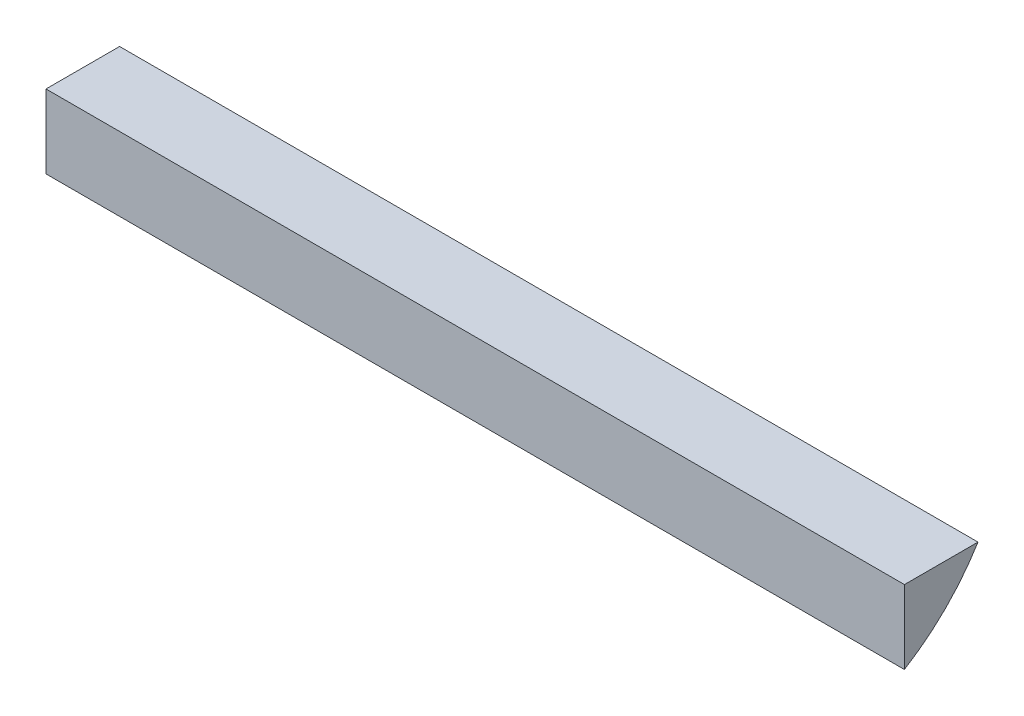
SolidWorks part; units mm, degrees
ref_plane "Face" through (0, 0, 0) normal (0, 0, 1) x (1, 0, 0)
ref_plane "Dessus" through (0, 0, 0) normal (0, 1, 0) x (1, 0, 0)
ref_plane "Droite" through (0, 0, 0) normal (1, 0, 0) x (0, 0, -1)
other "Cordon de soudure1"
